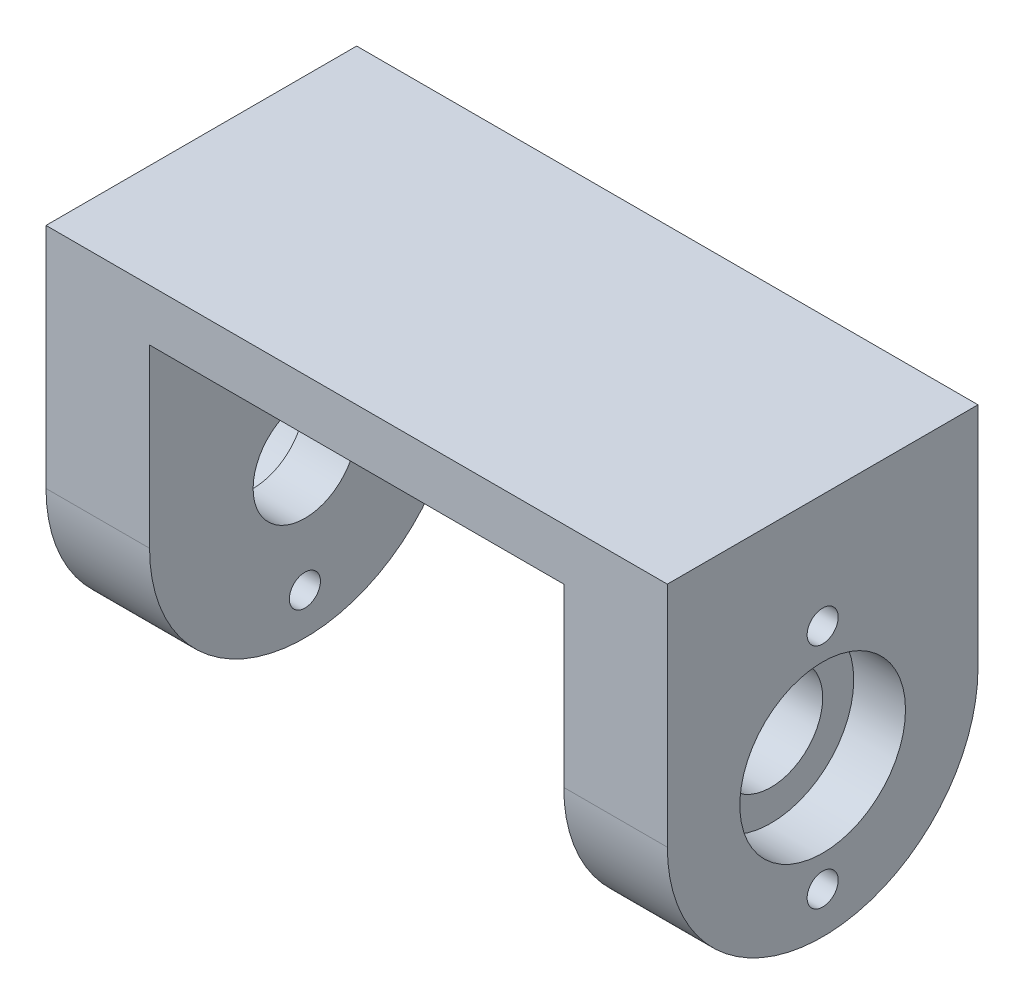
SolidWorks part; units mm, degrees
ref_plane "前视基准面" through (0, 0, 0) normal (0, 0, 1) x (1, 0, 0)
ref_plane "上视基准面" through (0, 0, 0) normal (0, 1, 0) x (1, 0, 0)
ref_plane "右视基准面" through (0, 0, 0) normal (1, 0, 0) x (0, 0, -1)
sketch "草图1" plane through (0, 0, 0) normal (1, 0, 0) x (0, 0, -1)
  line L0 (-15, 0) -> (-15, 22)
  line L1 (-15, 22) -> (15, 22)
  line L2 (15, 22) -> (15, 0)
  circle A0 centre (0, 0) radius 15
  circle A1 centre (0, 0) radius 5
  dimension "D1" = 30
  dimension "D3" = 10
  dimension "D2" = 22
extrude "凸台-拉伸1" add sketch "草图1" along normal blind 60 contours A0 L2 L1 L0 | A0 A1
sketch "草图3" plane through (0, 0, -15) normal (0, 0, -1) x (-1, 0, 0)
  line L0 (-60, 22) -> (-60, 0) construction
  line L1 (-10, 17) -> (-50, 17)
  line L2 (-10, 17) -> (-10, -43)
  line L3 (-10, -43) -> (-50, -43)
  line L4 (-50, 17) -> (-50, -43)
  line L5 (-60, 22) -> (0, 22) construction
  dimension "D1" = 40
  dimension "D2" = 10
  dimension "D3" = 5
  dimension "D4" = 60
extrude "切除-拉伸1" cut sketch "草图3" against normal up to surface (30 mm away)
sketch "草图4" plane through (0, 0, 0) normal (-1, 0, 0) x (0, 0, 1)
  circle A0 centre (0, 0) radius 8
  dimension "D1" = 16
extrude "切除-拉伸2" cut sketch "草图4" against normal blind 5
sketch "草图5" plane through (60, 0, 0) normal (1, 0, 0) x (0, 0, -1)
  circle A0 centre (0, 0) radius 8
  dimension "D1" = 16
extrude "切除-拉伸3" cut sketch "草图5" against normal blind 5
sketch "草图6" plane through (60, 0, 0) normal (1, 0, 0) x (0, 0, -1)
  circle A0 centre (0, -11) radius 1.5
  circle A1 centre (0, 11) radius 1.5
  circle A2 centre (0, 0) radius 8 construction
  dimension "D2" = 11
  dimension "D3" = 3
  dimension "D4" = 3
  dimension "D1" = 22
extrude "切除-拉伸4" cut sketch "草图6" against normal up to surface (60 mm away)
